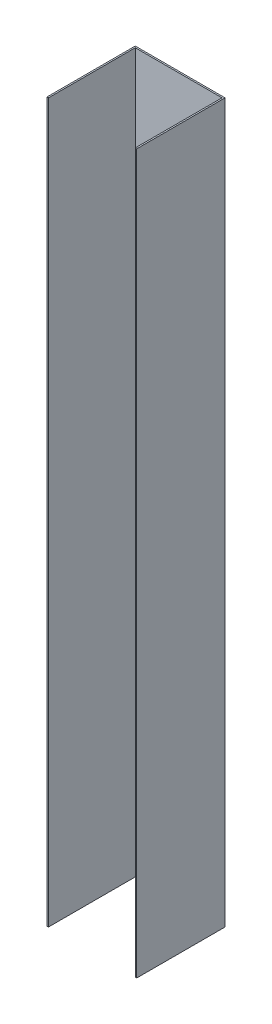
SolidWorks part; units mm, degrees
ref_plane "Plan de face" through (0, 0, 0) normal (0, 0, 1) x (1, 0, 0)
ref_plane "Plan de dessus" through (0, 0, 0) normal (0, 1, 0) x (1, 0, 0)
ref_plane "Plan de droite" through (0, 0, 0) normal (1, 0, 0) x (0, 0, -1)
sketch "EW_SKETCH" plane through (0, 0, 0) normal (0, 1, 0) x (1, 0, 0)
  line L0 (-30, 0) -> (30, 0)
  line L1 (30, 0) -> (30, -59)
  line L2 (30, -59) -> (29, -59)
  line L3 (29, -59) -> (29, -1)
  line L4 (29, -1) -> (-29, -1)
  line L5 (-29, -1) -> (-29, -59)
  line L6 (-29, -59) -> (-30, -59)
  line L7 (-30, -59) -> (-30, 0)
  line L8 (0, 0) -> (0, -60) construction
  point P11 (0, -30)
extrude "EW_EXTRUDE" add sketch "EW_SKETCH" along normal blind 480
equation "\"th_duct@EW_SKETCH\"=1"
equation "\"th_duct_form@EW_SKETCH\"=\"th_duct@EW_SKETCH\""
equation "\"d2_duct@EW_SKETCH\"=\"EW_HEIGHT@EW_SKETCH\"-\"th_duct@EW_SKETCH\""
